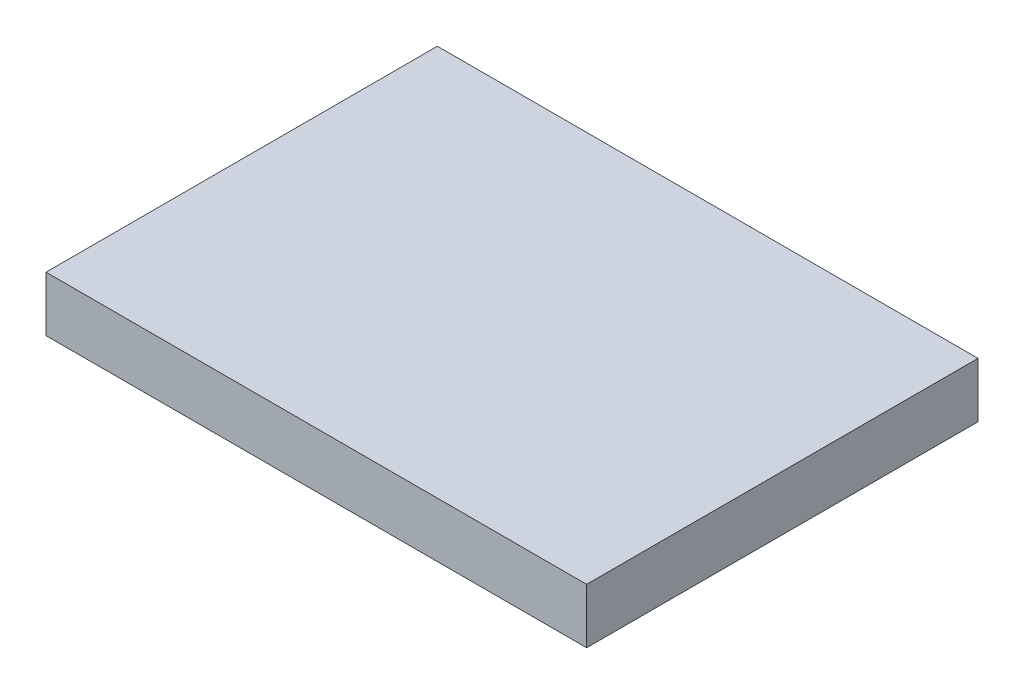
SolidWorks part; units mm, degrees
ref_plane "Front Plane" through (0, 0, 0) normal (0, 0, 1) x (1, 0, 0)
ref_plane "Top Plane" through (0, 0, 0) normal (0, 1, 0) x (1, 0, 0)
ref_plane "Right Plane" through (0, 0, 0) normal (1, 0, 0) x (0, 0, -1)
sketch "Sketch1" plane through (0, 0, 0) normal (0, 1, 0) x (1, 0, 0)
  line L1 (-99.9572, -72.3614) -> (99.9572, -72.3614)
  line L2 (-99.9572, -72.3614) -> (-99.9572, 72.3614)
  line L3 (-99.9572, 72.3614) -> (99.9572, 72.3614)
  line L4 (99.9572, -72.3614) -> (99.9572, 72.3614)
  line L5 (-99.9572, -72.3614) -> (99.9572, 72.3614) construction
  line L6 (-99.9572, 72.3614) -> (99.9572, -72.3614) construction
  point P0 (0, 0)
extrude "Boss-Extrude1" add sketch "Sketch1" along normal blind 20.32 contours L3 L4 L1 L2
